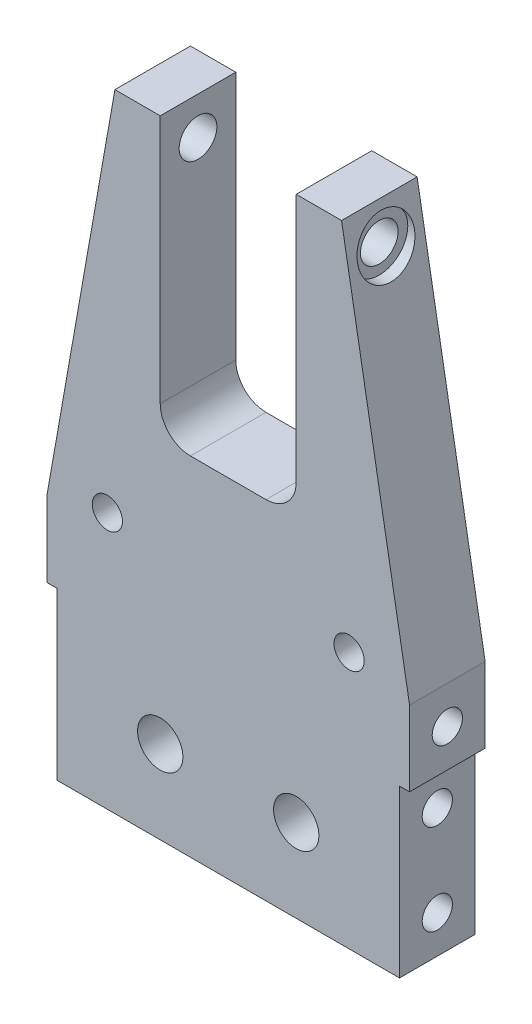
SolidWorks part; units mm, degrees
ref_plane "Front Plane" through (0, 0, 0) normal (0, 0, 1) x (1, 0, 0)
ref_plane "Top Plane" through (0, 0, 0) normal (0, 1, 0) x (1, 0, 0)
ref_plane "Right Plane" through (0, 0, 0) normal (1, 0, 0) x (0, 0, -1)
sketch "Sketch1" plane through (0, 0, 0) normal (0, 0, 1) x (1, 0, 0)
  line L0 (0, 0) -> (35.9918, 0)
  line L1 (35.9918, 0) -> (35.9918, 34.925)
  line L2 (-35.9918, 34.925) -> (-38.1, 34.925)
  line L3 (23.8125, 131.7498) -> (14.2875, 131.7498)
  line L4 (14.2875, 131.7498) -> (14.2875, 73.025)
  line L5 (14.2875, 73.025) -> (-14.2875, 73.025)
  line L6 (-14.2875, 73.025) -> (-14.2875, 131.7498)
  line L7 (-14.2875, 131.7498) -> (-23.8125, 131.7498)
  line L9 (-35.9918, 34.925) -> (-35.9918, 0)
  line L10 (-35.9918, 0) -> (0, 0)
  line L11 (0, 0) -> (0, 123.825) construction
  line L12 (0, 123.825) -> (-23.3128, 123.825) construction
  line L13 (0, 123.825) -> (26.0014, 123.825) construction
  line L14 (35.9918, 34.925) -> (38.1, 34.925)
  line L16 (0, 7.9248) -> (-35.9918, 7.9248) construction
  line L17 (0, 26.9748) -> (-35.9918, 26.9748) construction
  line L18 (0, 7.9248) -> (35.9918, 7.9248) construction
  line L19 (0, 26.9748) -> (35.9918, 26.9748) construction
  line L20 (-38.1, 34.925) -> (-38.1, 50.7214)
  line L21 (-38.1, 50.7214) -> (-23.8125, 131.7498)
  line L22 (38.1, 34.925) -> (38.1, 50.7214)
  line L23 (38.1, 50.7214) -> (23.8125, 131.7498)
  line L24 (0, 42.8498) -> (-38.1, 42.8498) construction
  line L25 (0, 42.8498) -> (38.1, 42.8498) construction
  circle A0 centre (-25.4, 53.975) radius 3.175
  circle A1 centre (25.4, 53.975) radius 3.175
  circle A2 centre (-14.2875, 17.4498) radius 4.7625
  circle A3 centre (14.2875, 17.4498) radius 4.7625
  dimension "D17" = 6.35
  dimension "D19" = 9.525
  dimension "D1" = 71.9836
  dimension "D2" = 34.925
  dimension "D3" = 88.9
  dimension "D4" = 7.9248
  dimension "D5" = 9.525
  dimension "D6" = 28.575
  dimension "D7" = 76.2
  dimension "D8" = 50.8
  dimension "D9" = 7.9248
  dimension "D10" = 19.05
  dimension "D11" = 7.9502
  dimension "D12" = 10
  dimension "D13" = 7.9248
  dimension "D14" = 7.8716
  dimension "D15" = 25.4
  dimension "D16" = 53.975
  dimension "D18" = 9.525
  dimension "D20" = 28.575
sketch "Sketch2" plane through (0, 0, 0) normal (0, 0, 1) x (1, 0, 0)
  line L0 (-35.9918, 0) -> (0, 0) construction
  line L1 (0, 0) -> (35.9918, 0) construction
  line L2 (35.9918, 0) -> (35.9918, 34.925) construction
  line L3 (35.9918, 34.925) -> (38.1, 34.925) construction
  line L5 (23.8125, 131.7498) -> (14.2875, 131.7498) construction
  line L6 (14.2875, 131.7498) -> (14.2875, 73.025) construction
  line L7 (14.2875, 73.025) -> (-14.2875, 73.025) construction
  line L8 (-14.2875, 73.025) -> (-14.2875, 131.7498) construction
  line L9 (-14.2875, 131.7498) -> (-23.8125, 131.7498) construction
  line L11 (-35.9918, 34.925) -> (-38.1, 34.925) construction
  line L12 (-35.9918, 34.925) -> (-35.9918, 0) construction
  line L13 (-35.9918, 0) -> (0, 0)
  line L14 (0, 0) -> (35.9918, 0)
  line L15 (35.9918, 0) -> (35.9918, 34.925)
  line L16 (35.9918, 34.925) -> (38.1, 34.925)
  line L17 (-38.1, 50.7214) -> (-23.8125, 131.7498) construction
  line L18 (23.8125, 131.7498) -> (14.2875, 131.7498)
  line L19 (14.2875, 131.7498) -> (14.2875, 73.025)
  line L20 (14.2875, 73.025) -> (-14.2875, 73.025)
  line L21 (-14.2875, 73.025) -> (-14.2875, 131.7498)
  line L22 (-14.2875, 131.7498) -> (-23.8125, 131.7498)
  line L23 (-38.1, 34.925) -> (-38.1, 50.7214) construction
  line L24 (-35.9918, 34.925) -> (-38.1, 34.925)
  line L25 (-35.9918, 34.925) -> (-35.9918, 0)
  line L26 (38.1, 34.925) -> (38.1, 50.7214) construction
  line L27 (38.1, 50.7214) -> (23.8125, 131.7498) construction
  line L28 (-38.1, 50.7214) -> (-23.8125, 131.7498)
  line L29 (-38.1, 34.925) -> (-38.1, 50.7214)
  line L30 (38.1, 34.925) -> (38.1, 50.7214)
  line L31 (38.1, 50.7214) -> (23.8125, 131.7498)
extrude "Boss-Extrude1" add sketch "Sketch2" along normal mid plane 15.875
sketch "Sketch3" plane through (0, 0, 0) normal (1, 0, 0) x (0, 0, -1)
  circle A0 centre (0, 123.825) radius 3.9624
  circle A1 centre (0, 123.825) radius 5.9944
  circle A2 centre (0, 26.9748) radius 3.175
  circle A3 centre (0, 7.9248) radius 3.175
  circle A4 centre (0, 42.8498) radius 3.175
  dimension "D1" = 7.9248
  dimension "D2" = 11.9888
  dimension "D3" = 6.35
  dimension "D4" = 6.35
sketch "Sketch4" plane through (0, 0, 0) normal (1, 0, 0) x (0, 0, -1)
  circle A0 centre (0, 123.825) radius 3.9624 construction
  circle A1 centre (0, 123.825) radius 3.9624
extrude "Cut-Extrude2" cut sketch "Sketch4" against normal mid plane 76.2
sketch "Sketch5" plane through (0, 0, 0) normal (1, 0, 0) x (0, 0, -1)
  circle A0 centre (0, 123.825) radius 5.9944 construction
  circle A1 centre (0, 123.825) radius 5.9944
extrude "Cut-Extrude3" cut sketch "Sketch5" against normal blind 25.4 from offset 22.225
sketch "Sketch6" plane through (0, 0, 0) normal (1, 0, 0) x (0, 0, -1)
  circle A0 centre (0, 123.825) radius 5.9944 construction
  circle A1 centre (0, 123.825) radius 5.9944
extrude "Cut-Extrude4" cut sketch "Sketch6" along normal blind 25.4 from offset 23.7998
sketch "Sketch7" plane through (0, 0, 0) normal (1, 0, 0) x (0, 0, -1)
  circle A0 centre (0, 7.9248) radius 3.175 construction
  circle A1 centre (0, 26.9748) radius 3.175 construction
  circle A2 centre (0, 7.9248) radius 3.175
  circle A3 centre (0, 26.9748) radius 3.175
extrude "Cut-Extrude5" cut sketch "Sketch7" along normal blind 25.4 from offset 15.24
sketch "Sketch8" plane through (0, 0, 0) normal (1, 0, 0) x (0, 0, -1)
  circle A0 centre (0, 7.9248) radius 3.175 construction
  circle A1 centre (0, 26.9748) radius 3.175 construction
  circle A2 centre (0, 7.9248) radius 3.175
  circle A3 centre (0, 26.9748) radius 3.175
extrude "Cut-Extrude6" cut sketch "Sketch8" against normal blind 25.4 from offset 15.24
sketch "Sketch9" plane through (0, 0, 0) normal (1, 0, 0) x (0, 0, -1)
  circle A0 centre (0, 42.8498) radius 3.175 construction
  circle A1 centre (0, 42.8498) radius 3.175
extrude "Cut-Extrude7" cut sketch "Sketch9" along normal blind 25.4 from offset 23.8252
sketch "Sketch10" plane through (0, 0, 0) normal (1, 0, 0) x (0, 0, -1)
  circle A0 centre (0, 42.8498) radius 3.175 construction
  circle A1 centre (0, 42.8498) radius 3.175
extrude "Cut-Extrude8" cut sketch "Sketch10" against normal blind 25.4 from offset 23.8252
fillet "Fillet1" radius 6.35 2 edges at (14.2875, 73.025, 0) (-14.2875, 73.025, 0)
sketch "Sketch11" plane through (0, 0, 0) normal (0, 0, 1) x (1, 0, 0)
  circle A0 centre (-25.4, 53.975) radius 3.175 construction
  circle A1 centre (25.4, 53.975) radius 3.175 construction
  circle A2 centre (-25.4, 53.975) radius 3.175
  circle A3 centre (25.4, 53.975) radius 3.175
  circle A4 centre (-14.2875, 17.4498) radius 4.7625 construction
  circle A5 centre (14.2875, 17.4498) radius 4.7625 construction
  circle A6 centre (-14.2875, 17.4498) radius 4.7625
  circle A7 centre (14.2875, 17.4498) radius 4.7625
extrude "Cut-Extrude9" cut sketch "Sketch11" against normal mid plane 25.4
chamfer "Chamfer1" distance 2.54 angle 41 2 edges at (-15.24, 26.9748, -3.175) (-15.24, 7.9248, -3.175)
chamfer "Chamfer2" distance 2.54 angle 41 2 edges at (15.24, 26.9748, -3.175) (15.24, 7.9248, -3.175)
